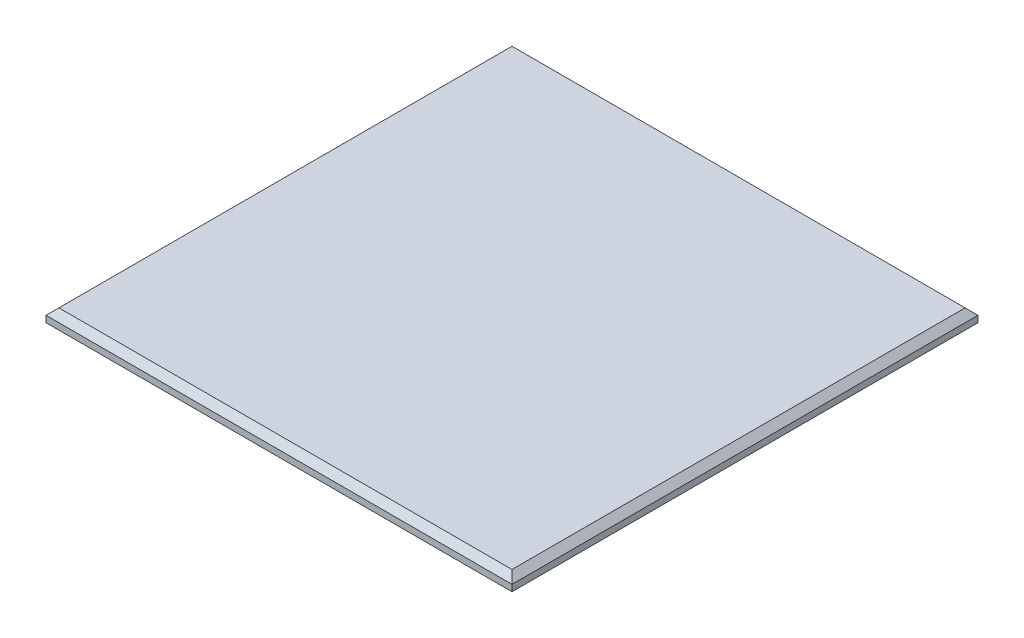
SolidWorks part; units mm, degrees
ref_plane "Front" through (0, 0, 0) normal (0, 0, 1) x (1, 0, 0)
ref_plane "Top" through (0, 0, 0) normal (0, 1, 0) x (1, 0, 0)
ref_plane "Right" through (0, 0, 0) normal (1, 0, 0) x (0, 0, -1)
sketch "Sketch1" plane through (0, 0, 0) normal (0, 1, 0) x (1, 0, 0)
  line L0 (-230, -230) -> (230, 230) construction
  line L1 (-230, 230) -> (230, 230)
  line L2 (-230, 230) -> (-230, -230)
  line L3 (-230, -230) -> (230, -230)
  line L4 (230, 230) -> (230, -230)
  dimension "D1" = 460
extrude "Base-Extrude" add sketch "Sketch1" along normal blind 12.7
chamfer "Chamfer1" distance 6.35 angle 45 4 edges at (230, 12.7, 0) (0, 12.7, -230) (-230, 12.7, 0) (0, 12.7, 230)
sketch "Sketch2" plane through (0, 12.7, 0) normal (0, 1, 0) x (-1, 0, 0)
  line L0 (-204.6, 204.6) -> (201.8, 204.6) construction
  line L1 (-204.6, 204.6) -> (-204.6, -201.8) construction
  line L2 (-223.65, 223.65) -> (-223.65, -223.65) construction
  line L3 (223.65, 223.65) -> (-223.65, 223.65) construction
  line L4 (-153.8, 204.6) -> (-153.8, -201.8) construction
  line L5 (-103, 204.6) -> (-103, -201.8) construction
  line L6 (-52.2, 204.6) -> (-52.2, -201.8) construction
  line L7 (-1.4, 204.6) -> (-1.4, -201.8) construction
  line L8 (49.4, 204.6) -> (49.4, -201.8) construction
  line L9 (100.2, 204.6) -> (100.2, -201.8) construction
  line L10 (151, 204.6) -> (151, -201.8) construction
  line L11 (201.8, 204.6) -> (201.8, -201.8) construction
  line L12 (-204.6, 153.8) -> (201.8, 153.8) construction
  line L13 (-204.6, 103) -> (201.8, 103) construction
  line L14 (-204.6, 52.2) -> (201.8, 52.2) construction
  line L15 (-204.6, 1.4) -> (201.8, 1.4) construction
  line L16 (-204.6, -49.4) -> (201.8, -49.4) construction
  line L17 (-204.6, -100.2) -> (201.8, -100.2) construction
  line L18 (-204.6, -151) -> (201.8, -151) construction
  line L19 (-204.6, -201.8) -> (201.8, -201.8) construction
  dimension "D1" = 19.05
  dimension "D2" = 19.05
  dimension "D3" = 406.4
  dimension "D4" = 406.4
  dimension "D5" = 50.8
  dimension "D6" = 50.8
ref_plane "Board Surface" through (0, 12.7, 0) normal (0, 1, 0) x (-1, 0, 0)
